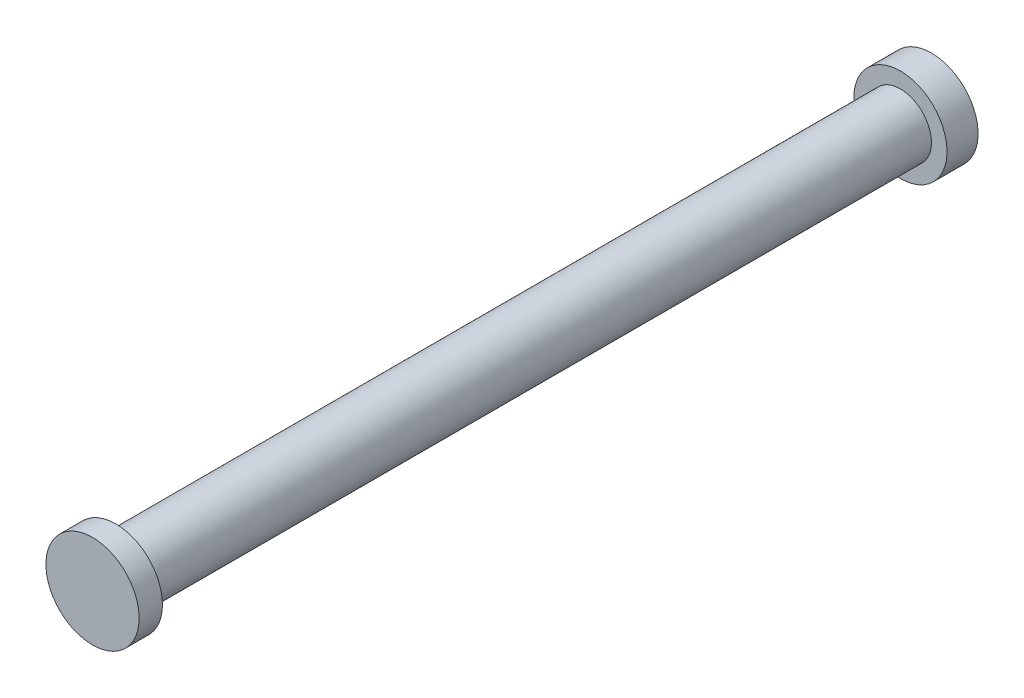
SolidWorks part; units mm, degrees
ref_plane "Front Plane" through (0, 0, 0) normal (0, 0, 1) x (1, 0, 0)
ref_plane "Top Plane" through (0, 0, 0) normal (0, 1, 0) x (1, 0, 0)
ref_plane "Right Plane" through (0, 0, 0) normal (1, 0, 0) x (0, 0, -1)
sketch "Sketch1" plane through (0, 0, 0) normal (0, 0, 1) x (1, 0, 0)
  circle A0 centre (0, 0) radius 6
extrude "Boss-Extrude1" add sketch "Sketch1" along normal blind 3
sketch "Sketch2" plane through (0, 0, 0) normal (0, 0, -1) x (-1, 0, 0)
  circle A0 centre (0, 0) radius 4
extrude "Boss-Extrude2" add sketch "Sketch2" along normal blind 101
sketch "Sketch3" plane through (0, 0, -101) normal (0, 0, -1) x (-1, 0, 0)
  circle A0 centre (0, 0) radius 6
extrude "Boss-Extrude3" add sketch "Sketch3" along normal blind 4
